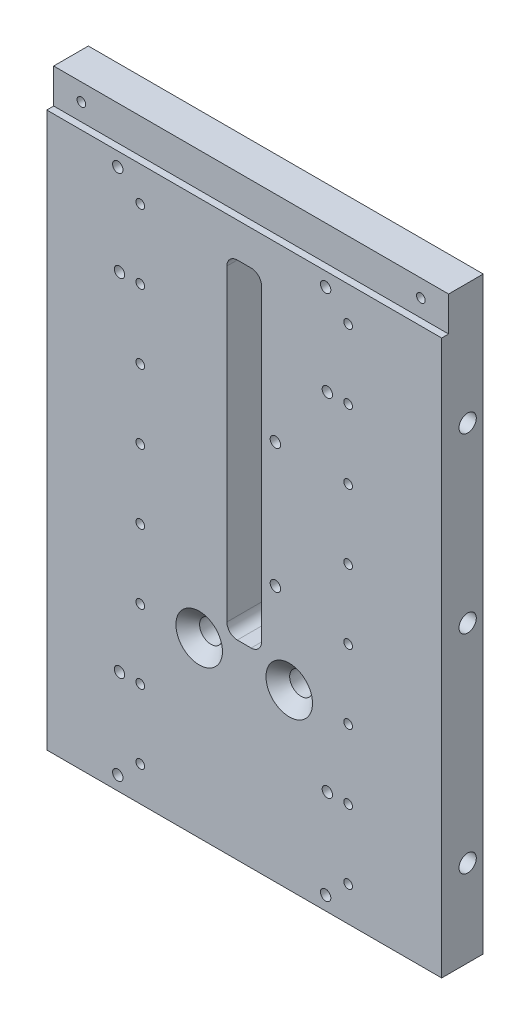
SolidWorks part; units mm, degrees
ref_plane "Front Plane" through (0, 0, 0) normal (0, 0, 1) x (1, 0, 0)
ref_plane "Top Plane" through (0, 0, 0) normal (0, 1, 0) x (1, 0, 0)
ref_plane "Right Plane" through (0, 0, 0) normal (1, 0, 0) x (0, 0, -1)
sketch "Sketch1" plane through (0, 0, 0) normal (0, 0, 1) x (1, 0, 0)
  line L1 (57, -85) -> (-57, -85)
  line L2 (57, -85) -> (57, 85)
  line L3 (57, 85) -> (-57, 85)
  line L4 (-57, -85) -> (-57, 85)
  line L5 (57, -85) -> (-57, 85) construction
  line L6 (57, 85) -> (-57, -85) construction
  point P0 (0, 0)
  dimension "D1" = 114
  dimension "D2" = 170
extrude "Boss-Extrude1" add sketch "Sketch1" along normal mid plane 12
sketch "Sketch3" plane through (0, 0, -6) normal (0, 0, -1) x (-1, 0, 0)
  line L1 (-5, -30) -> (5, -30)
  line L2 (-5, -30) -> (-5, 65)
  line L3 (-5, 65) -> (5, 65)
  line L4 (5, -30) -> (5, 65)
  dimension "D1" = 10
  dimension "D2" = 95
  dimension "D3" = 5
  dimension "D4" = 65
extrude "Cut-Extrude2" cut sketch "Sketch3" against normal through all
fillet "Fillet1" radius 3 4 edges at (5, 65, 0) (-5, 65, 0) (5, -30, 0) (-5, -30, 0)
sketch "Sketch12" plane through (57, 0, 0) normal (1, 0, 0) x (0, 0, -1)
  line L1 (-6, -85) -> (-6, 85) construction
  line L2 (-6, 85) -> (6, 85) construction
  line L3 (-6, 75) -> (-4, 75)
  line L4 (-6, 75) -> (-6, 85)
  line L5 (-6, 85) -> (-4, 85)
  line L6 (-4, 75) -> (-4, 85)
  dimension "D1" = 2
  dimension "D2" = 10
extrude "Cut-Extrude3" cut sketch "Sketch12" against normal through all
hole_wizard "M3x0.5 Tapped Hole4" positions "Sketch14" profile "Sketch13" tap size "M3x0.5" standard "ANSI Metric"
sketch "Sketch14" plane through (0, 0, 6) normal (0, 0, 1) x (1, 0, 0)
  line L0 (-57, 75) -> (-57, 85) construction
  line L1 (57, 75) -> (57, 85) construction
  line L2 (-57, 85) -> (57, 85) construction
  point P0 (-49, 80)
  point P2 (49, 80)
  point P5 (-57, 80)
  dimension "D1" = 8
  dimension "D2" = 8
  dimension "D3" = 5
  dimension "D4" = 5
sketch "Sketch13" plane through (-49, 80, 6) normal (1, 0, 0) x (0, -1, 0)
  line L0 (0, 0) -> (0, 8.2511)
  line L1 (0, 8.2511) -> (1.25, 7.5)
  line L2 (1.25, 7.5) -> (1.25, 0)
  line L5 (1.25, 0) -> (0, 0)
  line L10 (0, 8.2511) -> (-1.25, 7.5) construction
  line L11 (0, -6.35) -> (0, 107.95) construction
  dimension "Tap Drill Dia." = 2.5
  dimension "Tap Drill Depth" = 7.5
  dimension "Drill Angle" = 118
hole_wizard "Ø3.0 (3) Diameter Hole1" positions "Sketch17" profile "Sketch16" hole size "Ø3.0" standard "ANSI Metric"
sketch "Sketch17" plane through (0, 0, -6) normal (0, 0, -1) x (-1, 0, 0)
  line L0 (-57, -85) -> (-57, 41.5192) construction
  line L1 (-150, -85) -> (150, -85) construction
  point P0 (-9, -11)
  dimension "D1" = 48
  dimension "D2" = 74
sketch "Sketch16" plane through (9, -11, -6) normal (1, 0, 0) x (0, 1, 0)
  line L0 (0, 0) -> (0, 12)
  line L1 (0, 12) -> (1.5, 12)
  line L2 (1.5, 12) -> (1.5, 0)
  line L5 (1.5, 0) -> (0, 0)
  line L11 (0, -6.35) -> (0, 107.95) construction
  dimension "Thru Hole Dia." = 3
  dimension "Thru Hole Depth" = 12
hole_wizard "Ø3.0 (3) Diameter Hole3" positions "Sketch25" profile "Sketch24" hole size "Ø3.0" standard "ANSI Metric"
sketch "Sketch25" plane through (0, 0, -6) normal (0, 0, -1) x (-1, 0, 0)
  line L0 (-57, -85) -> (-57, 41.5192) construction
  line L1 (-150, -85) -> (150, -85) construction
  point P0 (-9, 25)
  dimension "D1" = 48
  dimension "D2" = 110
sketch "Sketch24" plane through (9, 25, -6) normal (1, 0, 0) x (0, 1, 0)
  line L0 (0, 0) -> (0, 12)
  line L1 (0, 12) -> (1.5, 12)
  line L2 (1.5, 12) -> (1.5, 0)
  line L5 (1.5, 0) -> (0, 0)
  line L11 (0, -6.35) -> (0, 107.95) construction
  dimension "Thru Hole Dia." = 3
  dimension "Thru Hole Depth" = 12
hole_wizard "M6x1.0 Tapped Hole1" positions "Sketch27" profile "Sketch26" tap size "M6x1.0" standard "ANSI Metric"
sketch "Sketch27" plane through (57, 0, 0) normal (1, 0, 0) x (0, 0, -1)
  point P0 (1.5, 50)
  point P3 (1.5, 0)
  point P6 (1.5, -60)
sketch "Sketch26" plane through (57, 50, -1.5) normal (0, 1, 0) x (0, 0, -1)
  line L0 (0, 0) -> (0, 16.5022)
  line L1 (0, 16.5022) -> (2.5, 15)
  line L2 (2.5, 15) -> (2.5, 0)
  line L5 (2.5, 0) -> (0, 0)
  line L10 (0, 16.5022) -> (-2.5, 15) construction
  line L11 (0, -6.35) -> (0, 107.95) construction
  dimension "Tap Drill Dia." = 5
  dimension "Tap Drill Depth" = 15
  dimension "Drill Angle" = 118
hole_wizard "M6x1.0 Tapped Hole2" positions "Sketch29" profile "Sketch28" tap size "M6x1.0" standard "ANSI Metric"
sketch "Sketch29" plane through (-57, 0, 0) normal (-1, 0, 0) x (0, 0, 1)
  point P0 (-1.5, 50)
  point P3 (-1.5, 0)
  point P6 (-1.5, -60)
sketch "Sketch28" plane through (-57, 50, -1.5) normal (0, 1, 0) x (0, 0, 1)
  line L0 (0, 0) -> (0, 16.5022)
  line L1 (0, 16.5022) -> (2.5, 15)
  line L2 (2.5, 15) -> (2.5, 0)
  line L5 (2.5, 0) -> (0, 0)
  line L10 (0, 16.5022) -> (-2.5, 15) construction
  line L11 (0, -6.35) -> (0, 107.95) construction
  dimension "Tap Drill Dia." = 5
  dimension "Tap Drill Depth" = 15
  dimension "Drill Angle" = 118
hole_wizard "CSK for M6 SFHCS1" positions "Sketch37" profile "Sketch36" countersink size "M6" standard "ANSI Metric"
sketch "Sketch37" plane through (0, 0, 6) normal (0, 0, 1) x (1, 0, 0)
  point P0 (-13, -35)
  point P3 (13, -35)
sketch "Sketch36" plane through (-13, -35, 6) normal (1, 0, 0) x (0, -1, 0)
  line L0 (0, 0) -> (0, 12)
  line L1 (0, 12) -> (3.3, 12)
  line L2 (3.3, 12) -> (3.3, 3.42)
  line L3 (3.3, 3.42) -> (6.72, 0)
  line L5 (6.72, 0) -> (0, 0)
  line L6 (-3.3, 3.42) -> (-6.72, 0) construction
  line L11 (0, -6.35) -> (0, 107.95) construction
  dimension "Thru Hole Dia." = 6.6
  dimension "Thru Hole Depth" = 12
  dimension "Near C'Sink Dia." = 13.44
  dimension "Near C'Sink Angle" = 90
hole_wizard "M3x0.5 Tapped Hole2" positions "Sketch39" profile "Sketch38" tap size "M3x0.5" standard "ANSI Metric"
sketch "Sketch39" plane through (0, 0, -6) normal (0, 0, -1) x (-1, 0, 0)
  point P0 (38.4042, 57.5)
  point P3 (38.4042, 17.5)
  point P6 (38.4042, -22.5)
sketch "Sketch38" plane through (-38.4042, 57.5, -6) normal (1, 0, 0) x (0, 1, 0)
  line L0 (0, 0) -> (0, 8.2511)
  line L1 (0, 8.2511) -> (1.25, 7.5)
  line L2 (1.25, 7.5) -> (1.25, 0)
  line L5 (1.25, 0) -> (0, 0)
  line L10 (0, 8.2511) -> (-1.25, 7.5) construction
  line L11 (0, -6.35) -> (0, 107.95) construction
  dimension "Tap Drill Dia." = 2.5
  dimension "Tap Drill Depth" = 7.5
  dimension "Drill Angle" = 118
hole_wizard "M3x0.5 Tapped Hole3" positions "Sketch41" profile "Sketch40" tap size "M3x0.5" standard "ANSI Metric"
sketch "Sketch41" plane through (0, 0, 6) normal (0, 0, 1) x (1, 0, 0)
  point P0 (-30, 65)
  point P3 (-30, 45)
  point P6 (-30, 25)
  point P9 (-30, 5)
  point P12 (-30, -15)
  point P15 (-30, -35)
  point P18 (-30, -55)
  point P21 (-30, -75)
  point P24 (30, -75)
  point P27 (30, -55)
  point P30 (30, -35)
  point P33 (30, -15)
  point P36 (30, 5)
  point P39 (30, 25)
  point P42 (30, 45)
  point P45 (30, 65)
sketch "Sketch40" plane through (-30, 65, 6) normal (1, 0, 0) x (0, -1, 0)
  line L0 (0, 0) -> (0, 5.0511)
  line L1 (0, 5.0511) -> (1.25, 4.3)
  line L2 (1.25, 4.3) -> (1.25, 0)
  line L5 (1.25, 0) -> (0, 0)
  line L10 (0, 5.0511) -> (-1.25, 4.3) construction
  line L11 (0, -6.35) -> (0, 107.95) construction
  dimension "Tap Drill Dia." = 2.5
  dimension "Tap Drill Depth" = 4.3
  dimension "Drill Angle" = 118
hole_wizard "Ø3.0 (3) Diameter Hole4" positions "Sketch44" profile "Sketch43" hole size "Ø3.0" standard "ANSI Metric"
sketch "Sketch44" plane through (0, 0, 6) normal (0, 0, 1) x (1, 0, 0)
  line L0 (-36, 45) -> (24, 45) construction
  line L1 (24, 45) -> (24, -55) construction
  line L2 (24, -55) -> (-36, -55) construction
  line L3 (-36, -55) -> (-36, 45) construction
  line L5 (-57, 75) -> (57, 75) construction
  point P0 (-36, 45)
  point P2 (24, 45)
  point P4 (24, -55)
  point P6 (-36, -55)
  dimension "D1" = 6
  dimension "D2" = 60
  dimension "D3" = 100
  dimension "D4" = 30
sketch "Sketch43" plane through (-36, 45, 6) normal (1, 0, 0) x (0, -1, 0)
  line L0 (0, 0) -> (0, 12)
  line L1 (0, 12) -> (1.5, 12)
  line L2 (1.5, 12) -> (1.5, 0)
  line L5 (1.5, 0) -> (0, 0)
  line L11 (0, -6.35) -> (0, 107.95) construction
  dimension "Thru Hole Dia." = 3
  dimension "Thru Hole Depth" = 12
hole_wizard "Ø3.0 (3) Diameter Hole5" positions "Sketch48" profile "Sketch47" hole size "Ø3.0" standard "ANSI Metric"
sketch "Sketch48" plane through (0, 0, 6) normal (0, 0, 1) x (1, 0, 0)
  line L0 (-36.5, 71) -> (23.5, 71) construction
  line L1 (23.5, 71) -> (23.5, -81) construction
  line L2 (23.5, -81) -> (-36.5, -81) construction
  line L3 (-36.5, -81) -> (-36.5, 71) construction
  line L5 (-57, 75) -> (-57, -85) construction
  line L6 (-57, -85) -> (57, -85) construction
  line L8 (-57, 75) -> (57, 75) construction
  point P0 (-36.5, 71)
  point P2 (-36.5, -81)
  point P4 (23.5, -81)
  point P6 (23.5, 71)
  dimension "D1" = 20.5
  dimension "D2" = 60
  dimension "D3" = 4
  dimension "D4" = 4
sketch "Sketch47" plane through (-36.5, 71, 6) normal (1, 0, 0) x (0, -1, 0)
  line L0 (0, 0) -> (0, 12)
  line L1 (0, 12) -> (1.5, 12)
  line L2 (1.5, 12) -> (1.5, 0)
  line L5 (1.5, 0) -> (0, 0)
  line L11 (0, -6.35) -> (0, 107.95) construction
  dimension "Thru Hole Dia." = 3
  dimension "Thru Hole Depth" = 12
